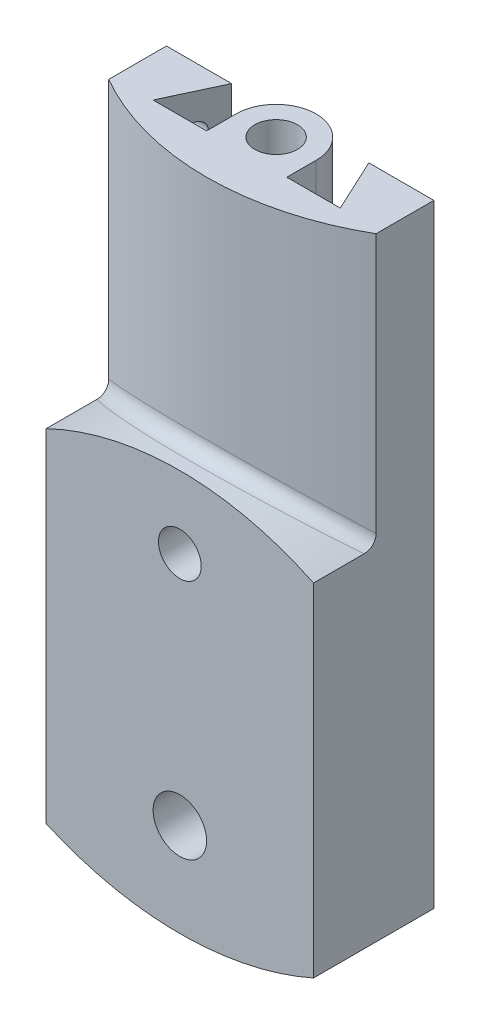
SolidWorks part; units mm, degrees
ref_plane "Front" through (0, 0, 0) normal (0, 0, 1) x (1, 0, 0)
ref_plane "Top" through (0, 0, 0) normal (0, 1, 0) x (1, 0, 0)
ref_plane "Right" through (0, 0, 0) normal (1, 0, 0) x (0, 0, -1)
sketch "Sketch4" plane through (0, 0, 0) normal (0, 1, 0) x (1, 0, 0)
  line L0 (-50, -21.6025) -> (-50, -35) construction
  line L1 (-50, -35) -> (50, -35) construction
  line L2 (-50, -21.6025) -> (-50, 0)
  line L3 (-50, 0) -> (50, 0)
  line L4 (50, -21.6025) -> (50, 0)
  line L5 (50, -21.6025) -> (50, -35) construction
  arc A0 (-50, -21.6025) -> (50, -21.6025) centre (0, 65) ccw
  dimension "D2" = 100
  dimension "D1" = 100
  dimension "D3" = 35
extrude "Extrude3" add sketch "Sketch4" along normal mid plane 240
sketch "Sketch6" plane through (0, 0, 0) normal (0, 0, 1) x (1, 0, 0)
  line L0 (-50, 120) -> (-50, -120) construction
  line L1 (50, 120) -> (50, -120) construction
  line L2 (-50, -120) -> (50, -120) construction
  arc A0 (-50, -109.3788) -> (50, -109.3788) centre (0, 3) ccw
  dimension "D1" = 123
extrude "Cut-Extrude1" cut sketch "Sketch6" against normal through all and the other way through all flip side to cut
ref_plane "Plane1" through (0, 0, 45) normal (0, 0, -1) x (-1, 0, 0)
sketch "Sketch8" plane through (0, 0, 45) normal (0, 0, -1) x (-1, 0, 0)
  line L0 (50, 120) -> (50, -109.3788) construction
  line L1 (-50, 120) -> (-50, -109.3788) construction
  line L2 (-50, 18.5616) -> (-50, -109.3788)
  line L3 (50, 18.5616) -> (50, -109.3788)
  arc A0 (50, 18.5616) -> (-50, 18.5616) centre (0, -85) ccw
  arc A1 (-50, -109.3788) -> (50, -109.3788) centre (0, 3) ccw construction
  arc A2 (-50, -109.3788) -> (50, -109.3788) centre (0, 3) ccw
  dimension "D1" = 115
  dimension "D2" = 35
extrude "Extrude4" add sketch "Sketch8" along normal up to next
sketch "Sketch9" plane through (0, 120, 0) normal (0, 1, 0) x (-1, 0, 0)
  line L0 (0, 0) -> (0, 47.0426) construction
  line L1 (25.6738, 0) -> (-25.6738, 0)
  line L2 (-50, 0) -> (50, 0) construction
  line L3 (-25.6738, 0) -> (-35, 20)
  line L4 (-35, 20) -> (35, 20)
  line L5 (25.6738, 0) -> (35, 20)
  point P9 (0, 20)
  dimension "D1" = 65
  dimension "D2" = 20
  dimension "D3" = 70
extrude "Cut-Extrude2" cut sketch "Sketch9" against normal through all
sketch "Sketch10" plane through (0, 120, 0) normal (0, 1, 0) x (-1, 0, 0)
  line L0 (-15, 20) -> (-15, 9)
  line L1 (35, 20) -> (-35, 20) construction
  line L2 (15, 9) -> (15, 20)
  line L3 (15, 20) -> (-15, 20)
  arc A0 (-15, 9) -> (15, 9) centre (0, 9) ccw
  dimension "D1" = 15
  dimension "D3" = 11
extrude "Extrude5" add sketch "Sketch10" against normal blind 25
sketch "Sketch11" plane through (0, 0, 20) normal (0, 0, -1) x (-1, 0, 0)
  line L0 (15, 95) -> (15, 120) construction
  line L1 (-15, 95) -> (15, 95)
  line L2 (-15, 95) -> (-15, -119.0819)
  line L4 (15, 95) -> (15, -119.0819)
  arc A0 (-35, -114.9152) -> (35, -114.9152) centre (0, 3) ccw construction
  arc A1 (-15, -119.0819) -> (15, -119.0819) centre (0, 3) ccw
extrude "Cut-Extrude3" cut sketch "Sketch11" against normal blind 1.5
sketch "Sketch12" plane through (0, 120, 0) normal (0, 1, 0) x (-1, 0, 0)
  arc A0 (-15, 9) -> (15, 9) centre (0, 9) ccw construction
  point P0 (0, 9)
other "Hole1"
sketch "Sketch13" plane through (0, 120, 0) normal (0, 1, 0) x (-1, 0, 0)
  circle A0 centre (0, 9) radius 8
  dimension "D1" = 16
sketch "Sketch14" plane through (0, 0, 45) normal (0, 0, 1) x (1, 0, 0)
  arc A0 (-50, -109.3788) -> (50, -109.3788) centre (0, 3) ccw construction
  point P0 (0, -85)
  point P1 (0, 3)
  dimension "D1" = 35
  dimension "D2" = 88
other "Hole2"
sketch "Sketch15" plane through (0, 0, 45) normal (0, 0, 1) x (1, 0, 0)
  circle A0 centre (0, 3) radius 8
  dimension "D1" = 16
other "Hole3"
sketch "Sketch16" plane through (0, 0, 45) normal (0, 0, 1) x (1, 0, 0)
  circle A0 centre (0, -85) radius 10
  dimension "D1" = 20
hole_wizard "M6.0 (6.000000) Diameter Hole1" positions "Sketch20" profile "Sketch19" hole size "M6.0" standard "Ansi Metric"
sketch "Sketch20" plane through (-50, 0, 0) normal (-1, 0, 0) x (0, 0, 1)
  line L0 (0, 120) -> (0, -109.3788) construction
  line L1 (0, 120) -> (21.6025, 120) construction
  point P0 (9, 107)
  dimension "D1" = 9
  dimension "D2" = 13
sketch "Sketch19" plane through (-50, 107, 9) normal (0, 1, 0) x (0, 0, 1)
  line L0 (0, 0) -> (0, 42)
  line L1 (0, 42) -> (3, 42)
  line L2 (3, 42) -> (3, 0)
  line L5 (3, 0) -> (0, 0)
  line L11 (0, -6.35) -> (0, 107.95) construction
  dimension "Thru Hole Dia." = 6
  dimension "Thru Hole Depth" = 42
pattern_linear "LPattern1" count 5 spacing 50
fillet "Fillet1" radius 5
